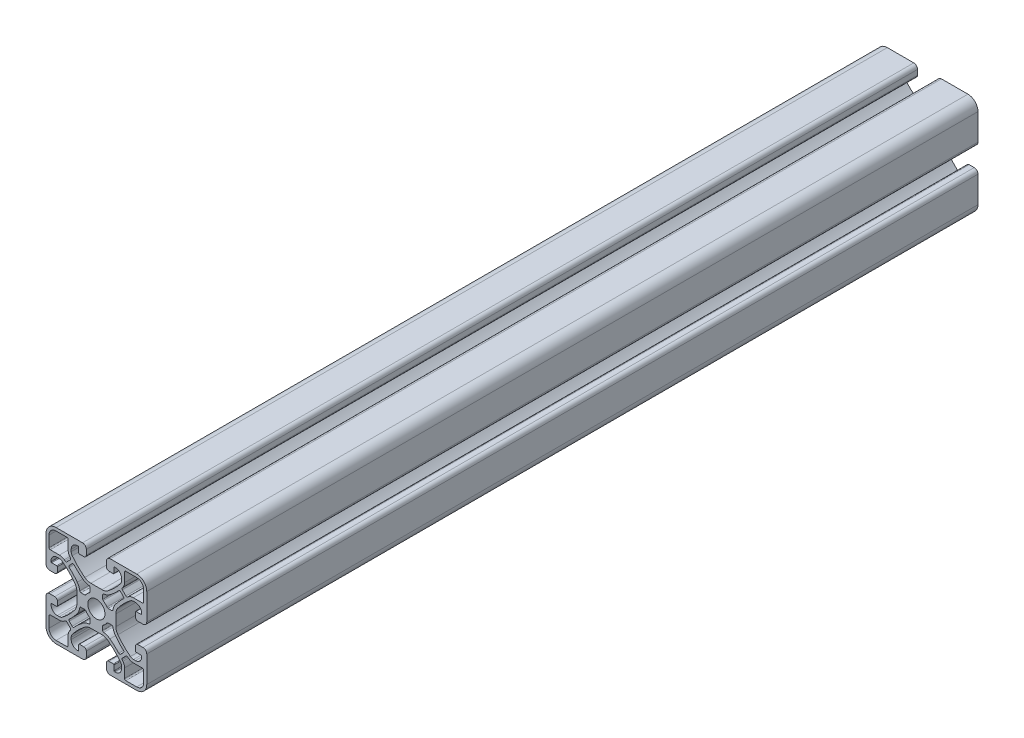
SolidWorks part; units mm, degrees
ref_plane "Face" through (0, 0, 0) normal (0, 0, 1) x (1, 0, 0)
ref_plane "Dessus" through (0, 0, 0) normal (0, 1, 0) x (1, 0, 0)
ref_plane "Droite" through (0, 0, 0) normal (1, 0, 0) x (0, 0, -1)
sketch "Esquisse profilé" plane through (0, 0, 0) normal (0, 0, 1) x (1, 0, 0)
  line L0 (11.6997, 18.8) -> (16, 18.8)
  line L1 (18.8, 16) -> (18.8, 11.7)
  line L2 (18.3, 11.2) -> (14.67, 11.2)
  line L3 (12.3957, 10.2874) -> (12.7389, 10.5517)
  line L4 (11.7339, 10.3275) -> (10.3272, 11.7342)
  line L5 (10.5513, 12.7393) -> (10.2871, 12.3961)
  line L6 (11.1997, 14.6704) -> (11.1997, 18.3)
  line L7 (-11.1997, 14.6699) -> (-11.1997, 18.3)
  line L8 (-10.5517, 12.7393) -> (-10.2874, 12.3961)
  line L9 (-11.7342, 10.3275) -> (-10.3275, 11.7342)
  line L10 (-12.3961, 10.2874) -> (-12.7393, 10.5517)
  line L11 (-18.3, 11.2) -> (-14.6704, 11.2)
  line L12 (-18.8, 16) -> (-18.8, 11.7)
  line L13 (-11.6997, 18.8) -> (-16, 18.8)
  line L14 (-2.5, 6.0982) -> (-2.5, 4.6098)
  line L15 (-4.6098, 2.5) -> (-6.0982, 2.5)
  line L16 (-10.7615, 9.6032) -> (-9.6032, 10.7615)
  line L17 (-10.7615, -9.6032) -> (-9.6032, -10.7615)
  line L18 (-4.6098, -2.5) -> (-6.0982, -2.5)
  line L19 (-2.5, -6.0982) -> (-2.5, -4.6098)
  line L20 (-11.7, -18.8) -> (-16, -18.8)
  line L21 (-18.8, -16) -> (-18.8, -11.7)
  line L22 (-18.3, -11.2) -> (-14.6704, -11.2)
  line L23 (-12.3961, -10.2874) -> (-12.7393, -10.5517)
  line L24 (-11.7342, -10.3275) -> (-10.3275, -11.7342)
  line L25 (-10.5517, -12.7393) -> (-10.2874, -12.3961)
  line L26 (-11.2, -14.6704) -> (-11.2, -18.3)
  line L27 (9.6032, 10.7615) -> (10.7615, 9.6032)
  line L28 (6.0982, 2.5) -> (4.6098, 2.5)
  line L29 (2.5, 4.6098) -> (2.5, 6.0982)
  line L30 (2.5, -4.6098) -> (2.5, -6.0982)
  line L31 (6.0982, -2.5) -> (4.6098, -2.5)
  line L32 (9.6032, -10.7615) -> (10.7615, -9.6032)
  line L33 (11.1997, -14.6704) -> (11.1997, -18.3)
  line L34 (10.5513, -12.7393) -> (10.2871, -12.3961)
  line L35 (11.7339, -10.3275) -> (10.3272, -11.7342)
  line L36 (12.3957, -10.2874) -> (12.7389, -10.5517)
  line L37 (18.3, -11.2) -> (14.67, -11.2)
  line L38 (18.8, -16) -> (18.8, -11.7)
  line L39 (11.6997, -18.8) -> (16, -18.8)
  line L40 (5.5, -20) -> (16, -20)
  line L41 (4, -16.5) -> (4, -18.5)
  line L42 (6.75, -15.5) -> (5, -15.5)
  line L43 (7, -17.75) -> (7, -15.75)
  line L44 (7.5, -18) -> (7.25, -18)
  line L45 (10, -14.7204) -> (10, -15.5)
  line L46 (-2.1931, -7.75) -> (2.1931, -7.75)
  line L47 (-10, -15.5) -> (-10, -14.7204)
  line L48 (-7.25, -18) -> (-7.5, -18)
  line L49 (-7, -15.75) -> (-7, -17.75)
  line L50 (-5, -15.5) -> (-6.75, -15.5)
  line L51 (-4, -18.5) -> (-4, -16.5)
  line L52 (-16, -20) -> (-5.5, -20)
  line L53 (-20, -5.5) -> (-20, -16)
  line L54 (-16.5, -4) -> (-18.5, -4)
  line L55 (-15.5, -6.75) -> (-15.5, -5)
  line L56 (-17.75, -7) -> (-15.75, -7)
  line L57 (-18, -7.5) -> (-18, -7.25)
  line L58 (-14.7204, -10) -> (-15.5, -10)
  line L59 (-7.75, 2.1931) -> (-7.75, -2.1931)
  line L60 (-15.5, 10) -> (-14.7204, 10)
  line L61 (-18, 7.25) -> (-18, 7.5)
  line L62 (-15.75, 7) -> (-17.75, 7)
  line L63 (-15.5, 5) -> (-15.5, 6.75)
  line L64 (-18.5, 4) -> (-16.5, 4)
  line L65 (-20, 16) -> (-20, 5.5)
  line L66 (-5.5, 20) -> (-16, 20)
  line L67 (-4, 16.5) -> (-4, 18.5)
  line L68 (-6.75, 15.5) -> (-5, 15.5)
  line L69 (-7, 17.75) -> (-7, 15.75)
  line L70 (-7.5, 18) -> (-7.25, 18)
  line L71 (-10, 14.7204) -> (-10, 15.5)
  line L72 (2.1931, 7.75) -> (-2.1931, 7.75)
  line L73 (10, 15.5) -> (10, 14.7204)
  line L74 (7.25, 18) -> (7.5, 18)
  line L75 (7, 15.75) -> (7, 17.75)
  line L76 (5, 15.5) -> (6.75, 15.5)
  line L77 (4, 18.5) -> (4, 16.5)
  line L78 (16, 20) -> (5.5, 20)
  line L79 (20, 5.5) -> (20, 16)
  line L80 (16.5, 4) -> (18.5, 4)
  line L81 (15.5, 6.75) -> (15.5, 5)
  line L82 (17.75, 7) -> (15.75, 7)
  line L83 (18, 7.5) -> (18, 7.25)
  line L84 (14.7204, 10) -> (15.5, 10)
  line L85 (7.75, -2.1931) -> (7.75, 2.1931)
  line L86 (15.5, -10) -> (14.7204, -10)
  line L87 (18, -7.25) -> (18, -7.5)
  line L88 (15.75, -7) -> (17.75, -7)
  line L89 (15.5, -5) -> (15.5, -6.75)
  line L90 (18.5, -4) -> (16.5, -4)
  line L91 (20, -16) -> (20, -5.5)
  arc A0 (11.1997, 18.3) -> (11.6997, 18.8) centre (11.6997, 18.3) cw
  arc A1 (-11.1997, 14.6699) -> (-10.5517, 12.7393) centre (-7.9997, 14.6699) ccw
  arc A2 (16, 18.8) -> (18.8, 16) centre (16, 16) cw
  arc A3 (18.8, 11.7) -> (18.3, 11.2) centre (18.3, 11.7) cw
  arc A4 (12.7389, 10.5517) -> (14.67, 11.2) centre (14.67, 8) cw
  arc A5 (12.3957, 10.2874) -> (11.7339, 10.3275) centre (12.0874, 10.6811) cw
  arc A6 (10.3272, 11.7342) -> (10.2871, 12.3961) centre (10.6807, 12.0878) cw
  arc A7 (11.1997, 14.6704) -> (10.5513, 12.7393) centre (7.9997, 14.6704) cw
  arc A8 (-10.3275, 11.7342) -> (-10.2874, 12.3961) centre (-10.6811, 12.0878) ccw
  arc A9 (-12.3961, 10.2874) -> (-11.7342, 10.3275) centre (-12.0878, 10.6811) ccw
  arc A10 (-12.7393, 10.5517) -> (-14.6704, 11.2) centre (-14.6704, 8) ccw
  arc A11 (-18.8, 11.7) -> (-18.3, 11.2) centre (-18.3, 11.7) ccw
  arc A12 (-16, 18.8) -> (-18.8, 16) centre (-16, 16) ccw
  arc A13 (-11.1997, 18.3) -> (-11.6997, 18.8) centre (-11.6997, 18.3) ccw
  arc A14 (-8.8828, 10.7477) -> (-5.38, 7.59) centre (10.34, 28.55) ccw
  arc A15 (-5.38, 7.59) -> (-2.9351, 6.594) centre (-2.26, 11.75) ccw
  arc A16 (-2.5, 6.0982) -> (-2.9351, 6.594) centre (-3, 6.0982) ccw
  arc A17 (-2.7273, 4.1907) -> (-2.5, 4.6098) centre (-3, 4.6098) ccw
  arc A18 (-2.7273, 4.1907) -> (-4.1907, 2.7273) centre (0, 0) ccw
  arc A19 (-4.6098, 2.5) -> (-4.1907, 2.7273) centre (-4.6098, 3) ccw
  arc A20 (-6.594, 2.9351) -> (-6.0982, 2.5) centre (-6.0982, 3) ccw
  arc A21 (-6.594, 2.9351) -> (-7.59, 5.38) centre (-11.75, 2.26) ccw
  arc A22 (-7.59, 5.38) -> (-10.7477, 8.8828) centre (-28.55, -10.34) ccw
  arc A23 (-10.7615, 9.6032) -> (-10.7477, 8.8828) centre (-10.4079, 9.2497) ccw
  arc A24 (-8.8828, 10.7477) -> (-9.6032, 10.7615) centre (-9.2497, 10.4079) ccw
  arc A25 (-8.8828, -10.7477) -> (-9.6032, -10.7615) centre (-9.2497, -10.4079) cw
  arc A26 (-10.7615, -9.6032) -> (-10.7477, -8.8828) centre (-10.4079, -9.2497) cw
  arc A27 (-7.59, -5.38) -> (-10.7477, -8.8828) centre (-28.55, 10.34) cw
  arc A28 (-6.594, -2.9351) -> (-7.59, -5.38) centre (-11.75, -2.26) cw
  arc A29 (-6.594, -2.9351) -> (-6.0982, -2.5) centre (-6.0982, -3) cw
  arc A30 (-4.6098, -2.5) -> (-4.1907, -2.7273) centre (-4.6098, -3) cw
  arc A31 (-2.7273, -4.1907) -> (-4.1907, -2.7273) centre (0, 0) cw
  arc A32 (-2.7273, -4.1907) -> (-2.5, -4.6098) centre (-3, -4.6098) cw
  arc A33 (-2.5, -6.0982) -> (-2.9351, -6.594) centre (-3, -6.0982) cw
  arc A34 (-5.38, -7.59) -> (-2.9351, -6.594) centre (-2.26, -11.75) cw
  arc A35 (-8.8828, -10.7477) -> (-5.38, -7.59) centre (10.34, -28.55) cw
  arc A36 (-11.2, -18.3) -> (-11.7, -18.8) centre (-11.7, -18.3) cw
  arc A37 (-16, -18.8) -> (-18.8, -16) centre (-16, -16) cw
  arc A38 (-18.8, -11.7) -> (-18.3, -11.2) centre (-18.3, -11.7) cw
  arc A39 (-12.7393, -10.5517) -> (-14.6704, -11.2) centre (-14.6704, -8) cw
  arc A40 (-12.3961, -10.2874) -> (-11.7342, -10.3275) centre (-12.0878, -10.6811) cw
  arc A41 (-10.3275, -11.7342) -> (-10.2874, -12.3961) centre (-10.6811, -12.0878) cw
  arc A42 (-11.2, -14.6704) -> (-10.5517, -12.7393) centre (-8, -14.6704) cw
  arc A43 (10.7477, 8.8828) -> (10.7615, 9.6032) centre (10.4079, 9.2497) ccw
  arc A44 (10.7477, 8.8828) -> (7.59, 5.38) centre (28.55, -10.34) ccw
  arc A45 (7.59, 5.38) -> (6.594, 2.9351) centre (11.75, 2.26) ccw
  arc A46 (6.0982, 2.5) -> (6.594, 2.9351) centre (6.0982, 3) ccw
  arc A47 (4.1907, 2.7273) -> (4.6098, 2.5) centre (4.6098, 3) ccw
  arc A48 (4.1907, 2.7273) -> (2.7273, 4.1907) centre (0, 0) ccw
  arc A49 (2.5, 4.6098) -> (2.7273, 4.1907) centre (3, 4.6098) ccw
  arc A50 (2.9351, 6.594) -> (2.5, 6.0982) centre (3, 6.0982) ccw
  arc A51 (2.9351, 6.594) -> (5.38, 7.59) centre (2.26, 11.75) ccw
  arc A52 (5.38, 7.59) -> (8.8828, 10.7477) centre (-10.34, 28.55) ccw
  arc A53 (9.6032, 10.7615) -> (8.8828, 10.7477) centre (9.2497, 10.4079) ccw
  arc A54 (9.6032, -10.7615) -> (8.8828, -10.7477) centre (9.2497, -10.4079) cw
  arc A55 (5.38, -7.59) -> (8.8828, -10.7477) centre (-10.34, -28.55) cw
  arc A56 (2.9351, -6.594) -> (5.38, -7.59) centre (2.26, -11.75) cw
  arc A57 (2.9351, -6.594) -> (2.5, -6.0982) centre (3, -6.0982) cw
  arc A58 (2.5, -4.6098) -> (2.7273, -4.1907) centre (3, -4.6098) cw
  arc A59 (4.1907, -2.7273) -> (2.7273, -4.1907) centre (0, 0) cw
  arc A60 (4.1907, -2.7273) -> (4.6098, -2.5) centre (4.6098, -3) cw
  arc A61 (6.0982, -2.5) -> (6.594, -2.9351) centre (6.0982, -3) cw
  arc A62 (7.59, -5.38) -> (6.594, -2.9351) centre (11.75, -2.26) cw
  arc A63 (10.7477, -8.8828) -> (7.59, -5.38) centre (28.55, 10.34) cw
  arc A64 (10.7477, -8.8828) -> (10.7615, -9.6032) centre (10.4079, -9.2497) cw
  arc A65 (11.1997, -14.6704) -> (10.5513, -12.7393) centre (7.9997, -14.6704) ccw
  arc A66 (10.3272, -11.7342) -> (10.2871, -12.3961) centre (10.6807, -12.0878) ccw
  arc A67 (12.3957, -10.2874) -> (11.7339, -10.3275) centre (12.0874, -10.6811) ccw
  arc A68 (12.7389, -10.5517) -> (14.67, -11.2) centre (14.67, -8) ccw
  arc A69 (18.8, -11.7) -> (18.3, -11.2) centre (18.3, -11.7) ccw
  arc A70 (16, -18.8) -> (18.8, -16) centre (16, -16) ccw
  arc A71 (11.1997, -18.3) -> (11.6997, -18.8) centre (11.6997, -18.3) ccw
  circle A72 centre (0, 0) radius 3.4
  arc A73 (16, -20) -> (20, -16) centre (16, -16) ccw
  arc A74 (4, -18.5) -> (5.5, -20) centre (5.5, -18.5) ccw
  arc A75 (5, -15.5) -> (4, -16.5) centre (5, -16.5) ccw
  arc A76 (7, -15.75) -> (6.75, -15.5) centre (6.75, -15.75) ccw
  arc A77 (7, -17.75) -> (7.25, -18) centre (7.25, -17.75) ccw
  arc A78 (7.5, -18) -> (10, -15.5) centre (7.5, -15.5) ccw
  arc A79 (10, -14.7204) -> (9.5948, -13.5134) centre (8, -14.7204) ccw
  arc A80 (9.5948, -13.5134) -> (4.5803, -8.5405) centre (-10.34, -28.6) ccw
  arc A81 (4.5803, -8.5405) -> (2.1931, -7.75) centre (2.1931, -11.75) ccw
  arc A82 (-2.1931, -7.75) -> (-4.5803, -8.5405) centre (-2.1931, -11.75) ccw
  arc A83 (-4.5803, -8.5405) -> (-9.5948, -13.5134) centre (10.34, -28.6) ccw
  arc A84 (-9.5948, -13.5134) -> (-10, -14.7204) centre (-8, -14.7204) ccw
  arc A85 (-10, -15.5) -> (-7.5, -18) centre (-7.5, -15.5) ccw
  arc A86 (-7.25, -18) -> (-7, -17.75) centre (-7.25, -17.75) ccw
  arc A87 (-6.75, -15.5) -> (-7, -15.75) centre (-6.75, -15.75) ccw
  arc A88 (-4, -16.5) -> (-5, -15.5) centre (-5, -16.5) ccw
  arc A89 (-5.5, -20) -> (-4, -18.5) centre (-5.5, -18.5) ccw
  arc A90 (-20, -16) -> (-16, -20) centre (-16, -16) ccw
  arc A91 (-18.5, -4) -> (-20, -5.5) centre (-18.5, -5.5) ccw
  arc A92 (-15.5, -5) -> (-16.5, -4) centre (-16.5, -5) ccw
  arc A93 (-15.75, -7) -> (-15.5, -6.75) centre (-15.75, -6.75) ccw
  arc A94 (-17.75, -7) -> (-18, -7.25) centre (-17.75, -7.25) ccw
  arc A95 (-18, -7.5) -> (-15.5, -10) centre (-15.5, -7.5) ccw
  arc A96 (-14.7204, -10) -> (-13.5134, -9.5948) centre (-14.7204, -8) ccw
  arc A97 (-13.5134, -9.5948) -> (-8.5405, -4.5803) centre (-28.6, 10.34) ccw
  arc A98 (-8.5405, -4.5803) -> (-7.75, -2.1931) centre (-11.75, -2.1931) ccw
  arc A99 (-7.75, 2.1931) -> (-8.5405, 4.5803) centre (-11.75, 2.1931) ccw
  arc A100 (-8.5405, 4.5803) -> (-13.5134, 9.5948) centre (-28.6, -10.34) ccw
  arc A101 (-13.5134, 9.5948) -> (-14.7204, 10) centre (-14.7204, 8) ccw
  arc A102 (-15.5, 10) -> (-18, 7.5) centre (-15.5, 7.5) ccw
  arc A103 (-18, 7.25) -> (-17.75, 7) centre (-17.75, 7.25) ccw
  arc A104 (-15.5, 6.75) -> (-15.75, 7) centre (-15.75, 6.75) ccw
  arc A105 (-16.5, 4) -> (-15.5, 5) centre (-16.5, 5) ccw
  arc A106 (-20, 5.5) -> (-18.5, 4) centre (-18.5, 5.5) ccw
  arc A107 (-16, 20) -> (-20, 16) centre (-16, 16) ccw
  arc A108 (-4, 18.5) -> (-5.5, 20) centre (-5.5, 18.5) ccw
  arc A109 (-5, 15.5) -> (-4, 16.5) centre (-5, 16.5) ccw
  arc A110 (-7, 15.75) -> (-6.75, 15.5) centre (-6.75, 15.75) ccw
  arc A111 (-7, 17.75) -> (-7.25, 18) centre (-7.25, 17.75) ccw
  arc A112 (-7.5, 18) -> (-10, 15.5) centre (-7.5, 15.5) ccw
  arc A113 (-10, 14.7204) -> (-9.5948, 13.5134) centre (-8, 14.7204) ccw
  arc A114 (-9.5948, 13.5134) -> (-4.5803, 8.5405) centre (10.34, 28.6) ccw
  arc A115 (-4.5803, 8.5405) -> (-2.1931, 7.75) centre (-2.1931, 11.75) ccw
  arc A116 (2.1931, 7.75) -> (4.5803, 8.5405) centre (2.1931, 11.75) ccw
  arc A117 (4.5803, 8.5405) -> (9.5948, 13.5134) centre (-10.34, 28.6) ccw
  arc A118 (9.5948, 13.5134) -> (10, 14.7204) centre (8, 14.7204) ccw
  arc A119 (10, 15.5) -> (7.5, 18) centre (7.5, 15.5) ccw
  arc A120 (7.25, 18) -> (7, 17.75) centre (7.25, 17.75) ccw
  arc A121 (6.75, 15.5) -> (7, 15.75) centre (6.75, 15.75) ccw
  arc A122 (4, 16.5) -> (5, 15.5) centre (5, 16.5) ccw
  arc A123 (5.5, 20) -> (4, 18.5) centre (5.5, 18.5) ccw
  arc A124 (20, 16) -> (16, 20) centre (16, 16) ccw
  arc A125 (18.5, 4) -> (20, 5.5) centre (18.5, 5.5) ccw
  arc A126 (15.5, 5) -> (16.5, 4) centre (16.5, 5) ccw
  arc A127 (15.75, 7) -> (15.5, 6.75) centre (15.75, 6.75) ccw
  arc A128 (17.75, 7) -> (18, 7.25) centre (17.75, 7.25) ccw
  arc A129 (18, 7.5) -> (15.5, 10) centre (15.5, 7.5) ccw
  arc A130 (14.7204, 10) -> (13.5134, 9.5948) centre (14.7204, 8) ccw
  arc A131 (13.5134, 9.5948) -> (8.5405, 4.5803) centre (28.6, -10.34) ccw
  arc A132 (8.5405, 4.5803) -> (7.75, 2.1931) centre (11.75, 2.1931) ccw
  arc A133 (7.75, -2.1931) -> (8.5405, -4.5803) centre (11.75, -2.1931) ccw
  arc A134 (8.5405, -4.5803) -> (13.5134, -9.5948) centre (28.6, 10.34) ccw
  arc A135 (13.5134, -9.5948) -> (14.7204, -10) centre (14.7204, -8) ccw
  arc A136 (15.5, -10) -> (18, -7.5) centre (15.5, -7.5) ccw
  arc A137 (18, -7.25) -> (17.75, -7) centre (17.75, -7.25) ccw
  arc A138 (15.5, -6.75) -> (15.75, -7) centre (15.75, -6.75) ccw
  arc A139 (16.5, -4) -> (15.5, -5) centre (16.5, -5) ccw
  arc A140 (20, -5.5) -> (18.5, -4) centre (18.5, -5.5) ccw
extrude "Extrusion1" add sketch "Esquisse profilé" along normal blind 330
